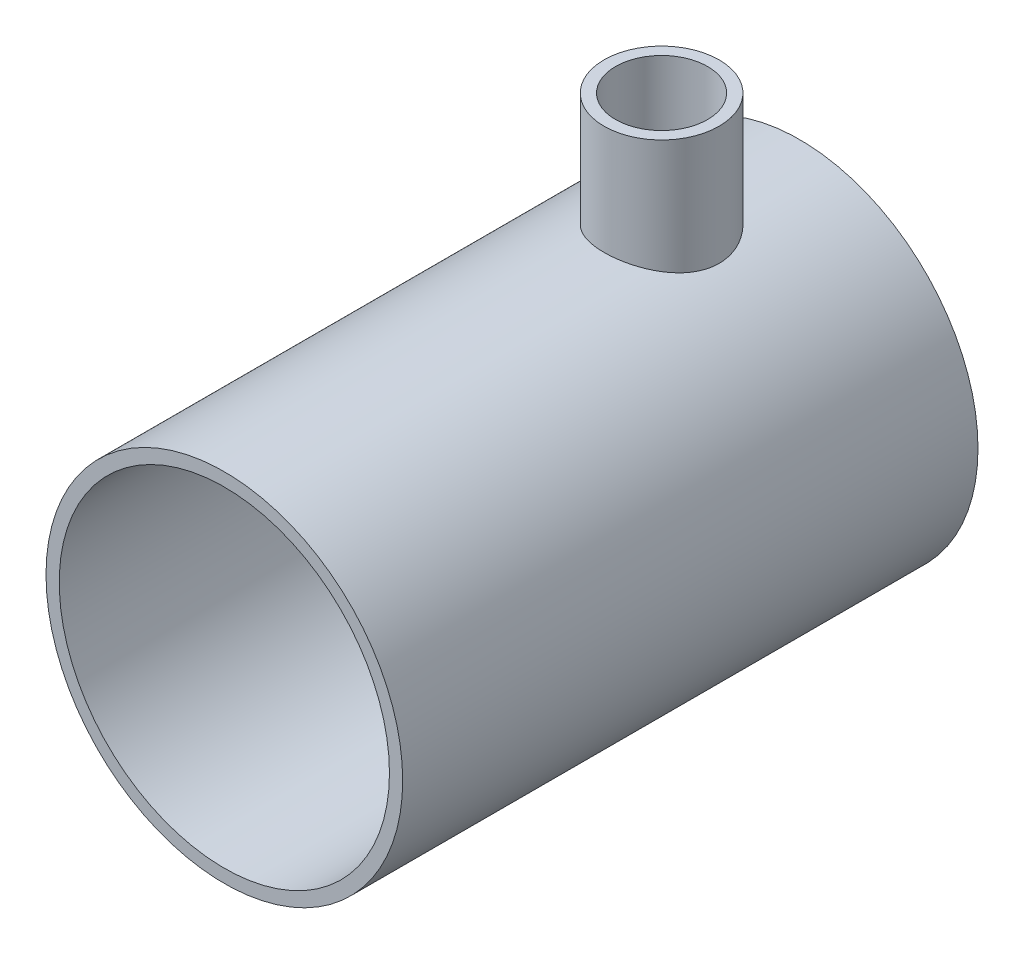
SolidWorks part; units mm, degrees
ref_plane "Alzado" through (0, 0, 0) normal (0, 0, 1) x (1, 0, 0)
ref_plane "Planta" through (0, 0, 0) normal (0, 1, 0) x (1, 0, 0)
ref_plane "Vista lateral" through (0, 0, 0) normal (1, 0, 0) x (0, 0, -1)
sketch "Croquis1" plane through (0, 0, 0) normal (0, 0, 1) x (1, 0, 0)
  circle A0 centre (0, 0) radius 15.5
  circle A1 centre (0, 0) radius 14.35
  dimension "D1" = 31
  dimension "D2" = 28.7
extrude "Saliente-Extruir1" add sketch "Croquis1" along normal blind 50
sketch "Croquis2" plane through (0, 0, 0) normal (0, 1, 0) x (1, 0, 0)
  circle A0 centre (0, -12) radius 5
  dimension "D1" = 10
  dimension "D2" = 12
extrude "Saliente-Extruir2" add sketch "Croquis2" along normal blind 25
sketch "Croquis3" plane through (0, 0, 50) normal (0, 0, 1) x (1, 0, 0)
  circle A0 centre (0, 0) radius 14.35
  dimension "D1" = 28.7
extrude "Cortar-Extruir1" cut sketch "Croquis3" against normal up to next
sketch "Croquis4" plane through (0, 25, 0) normal (0, 1, 0) x (1, 0, 0)
  circle A0 centre (0, -12) radius 4
  dimension "D1" = 8
extrude "Cortar-Extruir2" cut sketch "Croquis4" against normal up to next
